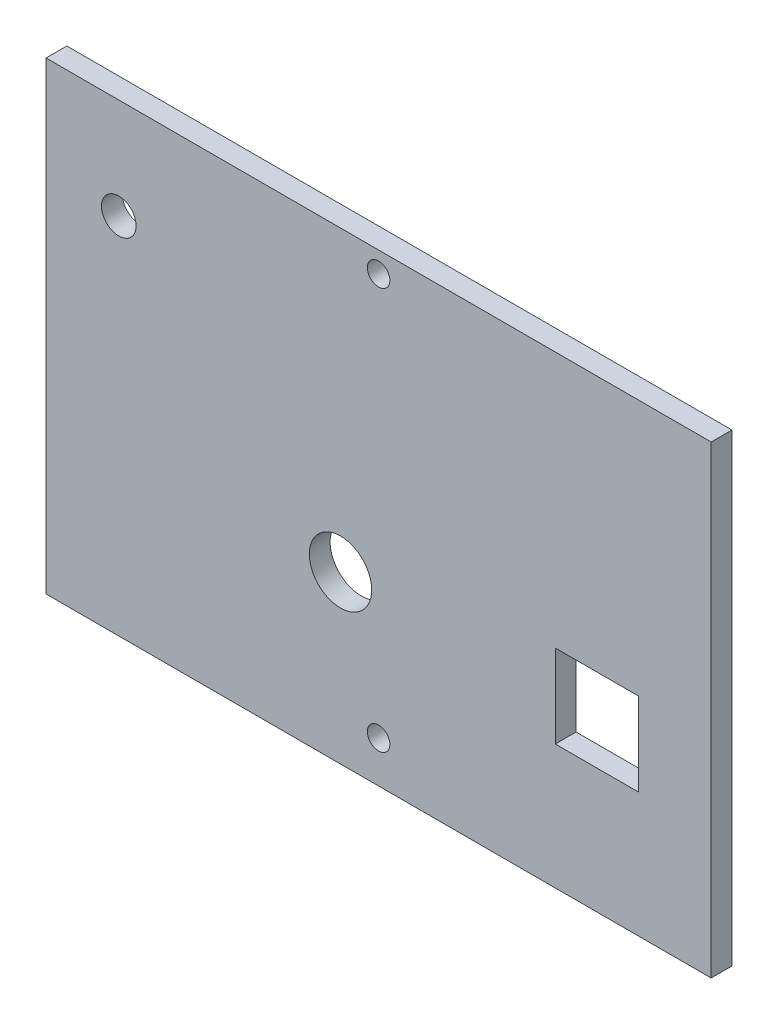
SolidWorks part; units mm, degrees
ref_plane "Alzado" through (0, 0, 0) normal (0, 0, 1) x (1, 0, 0)
ref_plane "Planta" through (0, 0, 0) normal (0, 1, 0) x (1, 0, 0)
ref_plane "Vista lateral" through (0, 0, 0) normal (1, 0, 0) x (0, 0, -1)
sketch "Croquis1" plane through (0, 0, 0) normal (0, 0, 1) x (1, 0, 0)
  line L1 (-48, -33.5) -> (48, -33.5)
  line L2 (-48, -33.5) -> (-48, 33.5)
  line L3 (-48, 33.5) -> (48, 33.5)
  line L4 (48, -33.5) -> (48, 33.5)
  line L5 (-48, -33.5) -> (48, 33.5) construction
  line L6 (-48, 33.5) -> (48, -33.5) construction
  point P0 (0, 0)
  dimension "D1" = 96
  dimension "D2" = 67
extrude "Saliente-Extruir1" add sketch "Croquis1" along normal blind 3
sketch "Croquis2" plane through (0, 0, 0) normal (0, 0, 1) x (1, 0, 0)
  line L0 (48, 33.5) -> (-48, 33.5) construction
  line L1 (-48, 33.5) -> (-48, -33.5) construction
  line L2 (-48, -33.5) -> (48, -33.5) construction
  line L3 (48, -33.5) -> (48, 33.5) construction
  line L4 (25.5, -3.5) -> (37.5, -3.5)
  line L5 (25.5, -3.5) -> (25.5, -15.5)
  line L6 (25.5, -15.5) -> (37.5, -15.5)
  line L7 (37.5, -3.5) -> (37.5, -15.5)
  line L8 (25.5, -3.5) -> (37.5, -15.5) construction
  line L9 (25.5, -15.5) -> (37.5, -3.5) construction
  circle A0 centre (-37.5, 19) radius 2.5
  circle A1 centre (-5.5, -9.5) radius 4.5
  circle A2 centre (0, 30.5) radius 1.625 construction
  circle A3 centre (0, -27.5) radius 1.625 construction
  circle A4 centre (0, 30.5) radius 1.625
  circle A5 centre (0, -27.5) radius 1.625
  point P10 (31.5, -9.5)
  dimension "D1" = 5
  dimension "D2" = 14.5
  dimension "D3" = 10.5
  dimension "D4" = 9
  dimension "D5" = 24
  dimension "D6" = 42.5
  dimension "D7" = 12
  dimension "D8" = 10.5
extrude "Cortar-Extruir1" cut sketch "Croquis2" along normal through all
sketch "Sketch3" plane through (0, 0, 3) normal (0, 0, 1) x (1, 0, 0)
  line L0 (-8.5534, 3.9138) -> (-10.3809, 5.4287)
  line L1 (-10.3809, 5.4287) -> (-11.4496, 5.4293)
  line L2 (-11.4594, 9.5301) -> (-10.3709, 9.5385)
  line L3 (-10.3709, 9.5385) -> (-8.4893, 11.097)
  line L4 (-13.2962, -3.2766) -> (-13.0236, -2.9318)
  line L5 (-13.0236, -2.9318) -> (-11.9522, -4.0032)
  line L6 (-11.9522, -4.0032) -> (-10.8808, -5.0746)
  line L7 (-10.8808, -5.0746) -> (-11.1578, -5.4598)
  line L8 (-12.4319, -8.8003) -> (-12.4544, -8.9466)
  line L9 (-12.4544, -8.9466) -> (-13.9772, -8.9466)
  line L10 (-13.9772, -8.9466) -> (-15.5, -8.9466)
  line L11 (-15.5, -8.9466) -> (-15.4742, -8.6833)
  line L12 (-11.1197, -3.158) -> (-12.1829, -2.0942)
  line L13 (-12.1829, -2.0942) -> (-12.034, -1.9601)
  line L14 (-6.3161, 0.4756) -> (-6.0918, 0.5)
  line L15 (-6.0918, 0.5) -> (-6.0918, -1.0438)
  line L16 (-6.0918, -1.0438) -> (-6.0918, -2.5876)
  line L17 (-6.0918, -2.5876) -> (-6.2186, -2.5876)
  line L18 (-13.2962, -3.2766) -> (-13.0236, -2.9318)
  line L19 (-13.0236, -2.9318) -> (-11.9522, -4.0032)
  line L20 (-11.9522, -4.0032) -> (-10.8808, -5.0746)
  line L21 (-10.8808, -5.0746) -> (-11.1578, -5.4598)
  line L22 (-12.4319, -8.8003) -> (-12.4544, -8.9466)
  line L23 (-12.4544, -8.9466) -> (-13.9772, -8.9466)
  line L24 (-13.9772, -8.9466) -> (-15.5, -8.9466)
  line L25 (-15.5, -8.9466) -> (-15.4742, -8.6833)
  line L26 (-11.1197, -3.158) -> (-12.1829, -2.0942)
  line L27 (-12.1829, -2.0942) -> (-12.034, -1.9601)
  line L28 (-6.3161, 0.4756) -> (-6.0918, 0.5)
  line L29 (-6.0918, 0.5) -> (-6.0918, -1.0438)
  line L30 (-6.0918, -1.0438) -> (-6.0918, -2.5876)
  line L31 (-6.0918, -2.5876) -> (-6.2186, -2.5876)
  line L32 (2.2962, -3.2797) -> (2.0236, -2.9349)
  line L33 (2.0236, -2.9349) -> (0.9522, -4.0063)
  line L34 (0.9522, -4.0063) -> (-0.1192, -5.0777)
  line L35 (-0.1192, -5.0777) -> (0.1578, -5.4629)
  line L36 (1.432, -8.8034) -> (1.4544, -8.9497)
  line L37 (1.4544, -8.9497) -> (2.9772, -8.9497)
  line L38 (2.9772, -8.9497) -> (4.5, -8.9497)
  line L39 (4.5, -8.9497) -> (4.4742, -8.6863)
  line L40 (0.1198, -3.161) -> (1.183, -2.0973)
  line L41 (1.183, -2.0973) -> (1.0341, -1.9632)
  line L42 (-4.6838, 0.4726) -> (-4.9082, 0.4969)
  line L43 (-4.9082, 0.4969) -> (-4.9082, -1.0469)
  line L44 (-4.9082, -1.0469) -> (-4.9082, -2.5907)
  line L45 (-4.9082, -2.5907) -> (-4.7814, -2.5907)
  spline S6 degree 3 poles (-0.8202, 1.6128) (-0.9788, 1.6868) (-1.1749, 1.8837) (-1.2459, 2.0401) knots 0 0 0 0 1 1 1 1
  spline S7 degree 3 poles (-1.2459, 2.0401) (-1.3134, 2.1887) (-1.3195, 2.4358) (-1.2593, 2.5799) knots 0 0 0 0 1 1 1 1
  spline S8 degree 3 poles (-1.2593, 2.5799) (-1.2353, 2.6374) (-1.1118, 2.8198) (-0.9849, 2.9853) knots 0 0 0 0 1 1 1 1
  spline S9 degree 3 poles (-0.9849, 2.9853) (-0.1909, 4.0204) (0.2972, 5.1684) (0.4875, 6.4482) knots 0 0 0 0 1 1 1 1
  spline S10 degree 3 poles (0.4875, 6.4482) (0.5521, 6.8829) (0.5739, 7.7404) (0.5311, 8.1623) knots 0 0 0 0 1 1 1 1
  spline S11 degree 3 poles (0.5311, 8.1623) (0.3809, 9.6412) (-0.1814, 11.0037) (-1.1081, 12.1347) knots 0 0 0 0 1 1 1 1
  spline S12 degree 3 poles (-1.1081, 12.1347) (-1.4073, 12.4997) (-1.4341, 12.5534) (-1.4339, 12.7873) knots 0 0 0 0 1 1 1 1
  spline S13 degree 3 poles (-1.4339, 12.7873) (-1.4338, 13.0274) (-1.3638, 13.1705) (-1.1544, 13.3588) knots 0 0 0 0 1 1 1 1
  spline S14 degree 3 poles (-1.1544, 13.3588) (-0.915, 13.574) (-0.6386, 13.6164) (-0.3646, 13.4798) knots 0 0 0 0 1 1 1 1
  spline S15 degree 3 poles (-0.3646, 13.4798) (-0.2018, 13.3988) (0.059, 13.1076) (0.4139, 12.6109) knots 0 0 0 0 1 1 1 1
  spline S16 degree 3 poles (0.4139, 12.6109) (2.55, 9.6214) (2.6127, 5.6441) (0.572, 2.5768) knots 0 0 0 0 1 1 1 1
  spline S17 degree 3 poles (0.572, 2.5768) (0.2805, 2.1386) (-0.02, 1.7704) (-0.1739, 1.6626) knots 0 0 0 0 1 1 1 1
  spline S18 degree 3 poles (-0.1739, 1.6626) (-0.3402, 1.5462) (-0.6298, 1.5239) (-0.8202, 1.6128) knots 0 0 0 0 1 1 1 1
  spline S19 degree 3 poles (-6.3936, 2.1887) (-6.5414, 2.2438) (-6.4712, 2.1877) (-8.5534, 3.9138) knots 0 0 0 0 1 1 1 1
  spline S20 degree 3 poles (-11.4496, 5.4293) (-12.4614, 5.4299) (-12.5254, 5.4332) (-12.6513, 5.4902) knots 0 0 0 0 1 1 1 1
  spline S21 degree 3 poles (-12.6513, 5.4902) (-12.8168, 5.5652) (-12.9049, 5.6462) (-12.9867, 5.798) knots 0 0 0 0 1 1 1 1
  spline S22 degree 3 poles (-12.9867, 5.798) (-13.0491, 5.914) (-13.0504, 5.9452) (-13.0587, 7.4165) knots 0 0 0 0 1 1 1 1
  spline S23 degree 3 poles (-13.0587, 7.4165) (-13.0641, 8.3817) (-13.0562, 8.9571) (-13.0366, 9.0299) knots 0 0 0 0 1 1 1 1
  spline S24 degree 3 poles (-13.0366, 9.0299) (-12.9899, 9.2034) (-12.8513, 9.3723) (-12.6909, 9.4513) knots 0 0 0 0 1 1 1 1
  spline S25 degree 3 poles (-12.6909, 9.4513) (-12.5492, 9.5211) (-12.5382, 9.5218) (-11.4594, 9.5301) knots 0 0 0 0 1 1 1 1
  spline S26 degree 3 poles (-8.4893, 11.097) (-7.4545, 11.9541) (-6.5691, 12.6801) (-6.5218, 12.7103) knots 0 0 0 0 1 1 1 1
  spline S27 degree 3 poles (-6.5218, 12.7103) (-6.4108, 12.7812) (-6.106, 12.8067) (-5.957, 12.7575) knots 0 0 0 0 1 1 1 1
  spline S28 degree 3 poles (-5.957, 12.7575) (-5.895, 12.737) (-5.7875, 12.6679) (-5.7179, 12.6037) knots 0 0 0 0 1 1 1 1
  spline S29 degree 3 poles (-5.7179, 12.6037) (-5.4811, 12.3855) (-5.4979, 12.7961) (-5.5066, 7.4221) knots 0 0 0 0 1 1 1 1
  spline S30 degree 3 poles (-5.5066, 7.4221) (-5.5138, 2.9591) (-5.5177, 2.6296) (-5.5652, 2.543) knots 0 0 0 0 1 1 1 1
  spline S31 degree 3 poles (-5.5652, 2.543) (-5.729, 2.2436) (-6.1068, 2.082) (-6.3936, 2.1887) knots 0 0 0 0 1 1 1 1
  spline S32 degree 3 poles (-3.1844, 3.9786) (-3.3419, 4.0501) (-3.5386, 4.2468) (-3.6101, 4.4043) knots 0 0 0 0 1 1 1 1
  spline S33 degree 3 poles (-3.6101, 4.4043) (-3.6448, 4.4807) (-3.6662, 4.5951) (-3.6666, 4.7063) knots 0 0 0 0 1 1 1 1
  spline S34 degree 3 poles (-3.6666, 4.7063) (-3.6672, 4.8614) (-3.6528, 4.909) (-3.5591, 5.061) knots 0 0 0 0 1 1 1 1
  spline S35 degree 3 poles (-3.5591, 5.061) (-3.2284, 5.5979) (-3.1539, 5.7359) (-3.0493, 6.0049) knots 0 0 0 0 1 1 1 1
  spline S36 degree 3 poles (-3.0493, 6.0049) (-2.5392, 7.3161) (-2.7224, 8.7295) (-3.5491, 9.8616) knots 0 0 0 0 1 1 1 1
  spline S37 degree 3 poles (-3.5491, 9.8616) (-3.805, 10.212) (-3.8478, 10.3544) (-3.7737, 10.6093) knots 0 0 0 0 1 1 1 1
  spline S38 degree 3 poles (-3.7737, 10.6093) (-3.7168, 10.8051) (-3.5172, 11.0405) (-3.3322, 11.13) knots 0 0 0 0 1 1 1 1
  spline S39 degree 3 poles (-3.3322, 11.13) (-3.1533, 11.2166) (-2.891, 11.2135) (-2.7188, 11.1228) knots 0 0 0 0 1 1 1 1
  spline S40 degree 3 poles (-2.7188, 11.1228) (-2.3902, 10.9497) (-1.7911, 9.978) (-1.5398, 9.2104) knots 0 0 0 0 1 1 1 1
  spline S41 degree 3 poles (-1.5398, 9.2104) (-1.333, 8.5788) (-1.2596, 8.0342) (-1.2822, 7.2982) knots 0 0 0 0 1 1 1 1
  spline S42 degree 3 poles (-1.2822, 7.2982) (-1.3009, 6.6874) (-1.3715, 6.2645) (-1.5408, 5.7489) knots 0 0 0 0 1 1 1 1
  spline S43 degree 3 poles (-1.5408, 5.7489) (-1.7247, 5.1889) (-2.2253, 4.2823) (-2.4595, 4.0853) knots 0 0 0 0 1 1 1 1
  spline S44 degree 3 poles (-2.4595, 4.0853) (-2.6611, 3.9156) (-2.9516, 3.8729) (-3.1844, 3.9786) knots 0 0 0 0 1 1 1 1
  spline S45 degree 3 poles (-12.3533, -16.8334) (-12.5644, -16.7047) (-13.2755, -15.8904) (-13.6875, -15.3056) knots 0 0 0 0 1 1 1 1
  spline S46 degree 3 poles (-13.6875, -15.3056) (-14.6338, -13.9625) (-15.2268, -12.412) (-15.4339, -10.7396) knots 0 0 0 0 1 1 1 1
  spline S47 degree 3 poles (-15.4339, -10.7396) (-15.4668, -10.4735) (-15.4938, -10.2246) (-15.4938, -10.1864) knots 0 0 0 0 1 1 1 1
  spline S48 degree 3 poles (-15.4938, -10.1864) (-15.4938, -10.121) (-15.4052, -10.117) (-13.9765, -10.117) knots 0 0 0 0 1 1 1 1
  spline S49 degree 3 poles (-13.9765, -10.117) (-12.3106, -10.117) (-12.4118, -10.1018) (-12.4118, -10.3522) knots 0 0 0 0 1 1 1 1
  spline S50 degree 3 poles (-12.4118, -10.3522) (-12.4118, -10.5585) (-12.2523, -11.2933) (-12.1167, -11.7117) knots 0 0 0 0 1 1 1 1
  spline S51 degree 3 poles (-12.1167, -11.7117) (-11.9396, -12.2584) (-11.5016, -13.1285) (-11.1734, -13.5856) knots 0 0 0 0 1 1 1 1
  spline S52 degree 3 poles (-11.1734, -13.5856) (-11.0285, -13.7876) (-10.7222, -14.15) (-10.493, -14.3911) knots 0 0 0 0 1 1 1 1
  spline S53 degree 3 poles (-10.493, -14.3911) (-9.8149, -15.1041) (-9.8174, -15.1137) (-10.932, -16.0891) knots 0 0 0 0 1 1 1 1
  spline S54 degree 3 poles (-10.932, -16.0891) (-11.3829, -16.4837) (-11.7906, -16.8281) (-11.838, -16.8545) knots 0 0 0 0 1 1 1 1
  spline S55 degree 3 poles (-11.838, -16.8545) (-11.9653, -16.9252) (-12.2198, -16.9148) (-12.3533, -16.8334) knots 0 0 0 0 1 1 1 1
  spline S56 degree 3 poles (-15.4742, -8.6833) (-15.2743, -6.6421) (-14.5652, -4.882) (-13.2962, -3.2766) knots 0 0 0 0 1 1 1 1
  spline S57 degree 3 poles (-11.1578, -5.4598) (-11.3102, -5.6717) (-11.5478, -6.0646) (-11.6857, -6.3328) knots 0 0 0 0 1 1 1 1
  spline S58 degree 3 poles (-11.6857, -6.3328) (-12.0744, -7.0882) (-12.2672, -7.7257) (-12.4319, -8.8003) knots 0 0 0 0 1 1 1 1
  spline S59 degree 3 poles (-12.034, -1.9601) (-11.5136, -1.4914) (-10.6988, -0.9406) (-9.997, -0.583) knots 0 0 0 0 1 1 1 1
  spline S60 degree 3 poles (-9.997, -0.583) (-8.8296, 0.0118) (-7.7635, 0.3184) (-6.3161, 0.4756) knots 0 0 0 0 1 1 1 1
  spline S61 degree 3 poles (-6.2186, -2.5876) (-6.3873, -2.5877) (-6.8943, -2.6785) (-7.2879, -2.7791) knots 0 0 0 0 1 1 1 1
  spline S62 degree 3 poles (-7.2879, -2.7791) (-8.1275, -2.9938) (-9.1702, -3.5132) (-9.798, -4.0295) knots 0 0 0 0 1 1 1 1
  spline S63 degree 3 poles (-9.798, -4.0295) (-9.8945, -4.1089) (-9.9922, -4.1846) (-10.015, -4.1978) knots 0 0 0 0 1 1 1 1
  spline S64 degree 3 poles (-10.015, -4.1978) (-10.0378, -4.211) (-10.5349, -3.743) (-11.1197, -3.1579) knots 0 0 0 0 1 1 1 1
  spline S65 degree 3 poles (-12.3533, -16.8334) (-12.5644, -16.7047) (-13.2755, -15.8904) (-13.6875, -15.3056) knots 0 0 0 0 1 1 1 1
  spline S66 degree 3 poles (-13.6875, -15.3056) (-14.6338, -13.9625) (-15.2268, -12.412) (-15.4339, -10.7396) knots 0 0 0 0 1 1 1 1
  spline S67 degree 3 poles (-15.4339, -10.7396) (-15.4668, -10.4735) (-15.4938, -10.2246) (-15.4938, -10.1864) knots 0 0 0 0 1 1 1 1
  spline S68 degree 3 poles (-15.4938, -10.1864) (-15.4938, -10.121) (-15.4052, -10.117) (-13.9765, -10.117) knots 0 0 0 0 1 1 1 1
  spline S69 degree 3 poles (-13.9765, -10.117) (-12.3106, -10.117) (-12.4118, -10.1018) (-12.4118, -10.3522) knots 0 0 0 0 1 1 1 1
  spline S70 degree 3 poles (-12.4118, -10.3522) (-12.4118, -10.5585) (-12.2523, -11.2933) (-12.1167, -11.7117) knots 0 0 0 0 1 1 1 1
  spline S71 degree 3 poles (-12.1167, -11.7117) (-11.9396, -12.2584) (-11.5016, -13.1285) (-11.1734, -13.5856) knots 0 0 0 0 1 1 1 1
  spline S72 degree 3 poles (-11.1734, -13.5856) (-11.0285, -13.7876) (-10.7222, -14.15) (-10.493, -14.3911) knots 0 0 0 0 1 1 1 1
  spline S73 degree 3 poles (-10.493, -14.3911) (-9.8149, -15.1041) (-9.8174, -15.1137) (-10.932, -16.0891) knots 0 0 0 0 1 1 1 1
  spline S74 degree 3 poles (-10.932, -16.0891) (-11.3829, -16.4837) (-11.7906, -16.8281) (-11.838, -16.8545) knots 0 0 0 0 1 1 1 1
  spline S75 degree 3 poles (-11.838, -16.8545) (-11.9653, -16.9252) (-12.2198, -16.9148) (-12.3533, -16.8334) knots 0 0 0 0 1 1 1 1
  spline S76 degree 3 poles (-15.4742, -8.6833) (-15.2743, -6.6421) (-14.5652, -4.882) (-13.2962, -3.2766) knots 0 0 0 0 1 1 1 1
  spline S77 degree 3 poles (-11.1578, -5.4598) (-11.3102, -5.6717) (-11.5478, -6.0646) (-11.6857, -6.3328) knots 0 0 0 0 1 1 1 1
  spline S78 degree 3 poles (-11.6857, -6.3328) (-12.0744, -7.0882) (-12.2672, -7.7257) (-12.4319, -8.8003) knots 0 0 0 0 1 1 1 1
  spline S79 degree 3 poles (-12.034, -1.9601) (-11.5136, -1.4914) (-10.6988, -0.9406) (-9.997, -0.583) knots 0 0 0 0 1 1 1 1
  spline S80 degree 3 poles (-9.997, -0.583) (-8.8296, 0.0118) (-7.7635, 0.3184) (-6.3161, 0.4756) knots 0 0 0 0 1 1 1 1
  spline S81 degree 3 poles (-6.2186, -2.5876) (-6.3873, -2.5877) (-6.8943, -2.6785) (-7.2879, -2.7791) knots 0 0 0 0 1 1 1 1
  spline S82 degree 3 poles (-7.2879, -2.7791) (-8.1275, -2.9938) (-9.1702, -3.5132) (-9.798, -4.0295) knots 0 0 0 0 1 1 1 1
  spline S83 degree 3 poles (-9.798, -4.0295) (-9.8945, -4.1089) (-9.9922, -4.1846) (-10.015, -4.1978) knots 0 0 0 0 1 1 1 1
  spline S84 degree 3 poles (-10.015, -4.1978) (-10.0378, -4.211) (-10.5349, -3.743) (-11.1197, -3.1579) knots 0 0 0 0 1 1 1 1
  spline S85 degree 3 poles (1.3533, -16.8365) (1.5644, -16.7078) (2.2755, -15.8935) (2.6875, -15.3087) knots 0 0 0 0 1 1 1 1
  spline S86 degree 3 poles (2.6875, -15.3087) (3.6339, -13.9655) (4.2269, -12.4151) (4.4339, -10.7427) knots 0 0 0 0 1 1 1 1
  spline S87 degree 3 poles (4.4339, -10.7427) (4.4668, -10.4766) (4.4938, -10.2277) (4.4938, -10.1895) knots 0 0 0 0 1 1 1 1
  spline S88 degree 3 poles (4.4938, -10.1895) (4.4938, -10.1241) (4.4052, -10.12) (2.9765, -10.12) knots 0 0 0 0 1 1 1 1
  spline S89 degree 3 poles (2.9765, -10.12) (1.3106, -10.12) (1.4118, -10.1048) (1.4118, -10.3553) knots 0 0 0 0 1 1 1 1
  spline S90 degree 3 poles (1.4118, -10.3553) (1.4118, -10.5616) (1.2523, -11.2964) (1.1168, -11.7148) knots 0 0 0 0 1 1 1 1
  spline S91 degree 3 poles (1.1168, -11.7148) (0.9396, -12.2615) (0.5017, -13.1316) (0.1735, -13.5887) knots 0 0 0 0 1 1 1 1
  spline S92 degree 3 poles (0.1735, -13.5887) (0.0285, -13.7906) (-0.2777, -14.1531) (-0.507, -14.3942) knots 0 0 0 0 1 1 1 1
  spline S93 degree 3 poles (-0.507, -14.3942) (-1.1851, -15.1072) (-1.1826, -15.1167) (-0.0679, -16.0922) knots 0 0 0 0 1 1 1 1
  spline S94 degree 3 poles (-0.0679, -16.0922) (0.383, -16.4868) (0.7907, -16.8312) (0.838, -16.8575) knots 0 0 0 0 1 1 1 1
  spline S95 degree 3 poles (0.838, -16.8575) (0.9653, -16.9283) (1.2199, -16.9179) (1.3533, -16.8365) knots 0 0 0 0 1 1 1 1
  spline S96 degree 3 poles (4.4742, -8.6863) (4.2743, -6.6452) (3.5653, -4.885) (2.2962, -3.2797) knots 0 0 0 0 1 1 1 1
  spline S97 degree 3 poles (0.1578, -5.4629) (0.3102, -5.6748) (0.5478, -6.0676) (0.6858, -6.3358) knots 0 0 0 0 1 1 1 1
  spline S98 degree 3 poles (0.6858, -6.3358) (1.0745, -7.0913) (1.2672, -7.7288) (1.432, -8.8034) knots 0 0 0 0 1 1 1 1
  spline S99 degree 3 poles (1.0341, -1.9632) (0.5136, -1.4945) (-0.3011, -0.9437) (-1.003, -0.5861) knots 0 0 0 0 1 1 1 1
  spline S100 degree 3 poles (-1.003, -0.5861) (-2.1704, 0.0088) (-3.2364, 0.3154) (-4.6838, 0.4726) knots 0 0 0 0 1 1 1 1
  spline S101 degree 3 poles (-4.7814, -2.5907) (-4.6127, -2.5908) (-4.1057, -2.6816) (-3.7121, -2.7822) knots 0 0 0 0 1 1 1 1
  spline S102 degree 3 poles (-3.7121, -2.7822) (-2.8725, -2.9969) (-1.8297, -3.5163) (-1.202, -4.0325) knots 0 0 0 0 1 1 1 1
  spline S103 degree 3 poles (-1.202, -4.0325) (-1.1054, -4.1119) (-1.0078, -4.1877) (-0.9849, -4.2008) knots 0 0 0 0 1 1 1 1
  spline S104 degree 3 poles (-0.9849, -4.2008) (-0.9621, -4.214) (-0.465, -3.7461) (0.1198, -3.161) knots 0 0 0 0 1 1 1 1
sketch "Sketch4" plane through (0, 0, 3) normal (0, 0, 1) x (1, 0, 0)
  circle A0 centre (-37.5, 19) radius 2.5 construction
  spline S8 degree 3 poles (-37.6749, 14.0491) (-37.7146, 14.0761) (-37.7676, 14.126) (-37.7928, 14.1599) knots 0 0 0 0 1 1 1 1
  spline S9 degree 3 poles (-37.7928, 14.1599) (-37.8364, 14.2188) (-37.8384, 14.2472) (-37.8384, 14.8079) knots 0 0 0 0 1 1 1 1
  spline S10 degree 3 poles (-37.8384, 14.8079) (-37.8384, 15.3686) (-37.8364, 15.3969) (-37.7928, 15.4558) knots 0 0 0 0 1 1 1 1
  spline S11 degree 3 poles (-37.7928, 15.4558) (-37.7676, 15.4897) (-37.7146, 15.5396) (-37.6749, 15.5666) knots 0 0 0 0 1 1 1 1
  spline S12 degree 3 poles (-37.6749, 15.5666) (-37.6253, 15.6003) (-37.5706, 15.6157) (-37.5, 15.6157) knots 0 0 0 0 1 1 1 1
  spline S13 degree 3 poles (-37.5, 15.6157) (-37.4294, 15.6157) (-37.3747, 15.6003) (-37.3251, 15.5666) knots 0 0 0 0 1 1 1 1
  spline S14 degree 3 poles (-37.3251, 15.5666) (-37.2854, 15.5396) (-37.2324, 15.4897) (-37.2072, 15.4558) knots 0 0 0 0 1 1 1 1
  spline S15 degree 3 poles (-37.2072, 15.4558) (-37.1636, 15.3969) (-37.1616, 15.3686) (-37.1616, 14.8079) knots 0 0 0 0 1 1 1 1
  spline S16 degree 3 poles (-37.1616, 14.8079) (-37.1616, 14.2471) (-37.1636, 14.2188) (-37.2072, 14.1599) knots 0 0 0 0 1 1 1 1
  spline S17 degree 3 poles (-37.2072, 14.1599) (-37.2324, 14.126) (-37.2854, 14.0761) (-37.3251, 14.0491) knots 0 0 0 0 1 1 1 1
  spline S18 degree 3 poles (-37.3251, 14.0491) (-37.3747, 14.0154) (-37.4294, 14) (-37.5, 14) knots 0 0 0 0 1 1 1 1
  spline S19 degree 3 poles (-37.5, 14) (-37.5706, 14) (-37.6253, 14.0154) (-37.6749, 14.0491) knots 0 0 0 0 1 1 1 1
  spline S20 degree 3 poles (-40.9439, 15.3966) (-40.9972, 15.4208) (-41.0548, 15.469) (-41.0803, 15.5107) knots 0 0 0 0 1 1 1 1
  spline S21 degree 3 poles (-41.0803, 15.5107) (-41.1045, 15.5505) (-41.1304, 15.6153) (-41.1379, 15.6549) knots 0 0 0 0 1 1 1 1
  spline S22 degree 3 poles (-41.1379, 15.6549) (-41.1463, 15.6995) (-41.1381, 15.762) (-41.1161, 15.8195) knots 0 0 0 0 1 1 1 1
  spline S23 degree 3 poles (-41.1161, 15.8195) (-41.0897, 15.8885) (-40.982, 16.0102) (-40.6932, 16.2971) knots 0 0 0 0 1 1 1 1
  spline S24 degree 3 poles (-40.6932, 16.2971) (-40.3677, 16.6204) (-40.2926, 16.6844) (-40.2238, 16.6971) knots 0 0 0 0 1 1 1 1
  spline S25 degree 3 poles (-40.2238, 16.6971) (-40.1788, 16.7054) (-40.1056, 16.7054) (-40.0611, 16.6971) knots 0 0 0 0 1 1 1 1
  spline S26 degree 3 poles (-40.0611, 16.6971) (-40.0104, 16.6876) (-39.9501, 16.6517) (-39.8992, 16.6008) knots 0 0 0 0 1 1 1 1
  spline S27 degree 3 poles (-39.8992, 16.6008) (-39.8482, 16.5499) (-39.8124, 16.4896) (-39.8029, 16.4389) knots 0 0 0 0 1 1 1 1
  spline S28 degree 3 poles (-39.8029, 16.4389) (-39.7946, 16.3944) (-39.7946, 16.3212) (-39.8029, 16.2762) knots 0 0 0 0 1 1 1 1
  spline S29 degree 3 poles (-39.8029, 16.2762) (-39.8155, 16.2077) (-39.8792, 16.1324) (-40.1929, 15.8152) knots 0 0 0 0 1 1 1 1
  spline S30 degree 3 poles (-40.1929, 15.8152) (-40.4232, 15.5821) (-40.6013, 15.4204) (-40.655, 15.3954) knots 0 0 0 0 1 1 1 1
  spline S31 degree 3 poles (-40.655, 15.3954) (-40.7031, 15.373) (-40.7669, 15.3547) (-40.7969, 15.3547) knots 0 0 0 0 1 1 1 1
  spline S32 degree 3 poles (-40.7969, 15.3547) (-40.827, 15.3547) (-40.8931, 15.3735) (-40.9439, 15.3966) knots 0 0 0 0 1 1 1 1
  spline S33 degree 3 poles (-34.345, 15.3954) (-34.3986, 15.4204) (-34.577, 15.5823) (-34.8073, 15.8152) knots 0 0 0 0 1 1 1 1
  spline S34 degree 3 poles (-34.8073, 15.8152) (-35.0439, 16.0544) (-35.1879, 16.217) (-35.1975, 16.2557) knots 0 0 0 0 1 1 1 1
  spline S35 degree 3 poles (-35.1975, 16.2557) (-35.2059, 16.2894) (-35.208, 16.3598) (-35.2021, 16.412) knots 0 0 0 0 1 1 1 1
  spline S36 degree 3 poles (-35.2021, 16.412) (-35.1962, 16.4642) (-35.1707, 16.5361) (-35.1453, 16.5718) knots 0 0 0 0 1 1 1 1
  spline S37 degree 3 poles (-35.1453, 16.5718) (-35.1199, 16.6074) (-35.0655, 16.6525) (-35.0245, 16.672) knots 0 0 0 0 1 1 1 1
  spline S38 degree 3 poles (-35.0245, 16.672) (-34.9834, 16.6915) (-34.909, 16.7075) (-34.8592, 16.7075) knots 0 0 0 0 1 1 1 1
  spline S39 degree 3 poles (-34.8592, 16.7075) (-34.8094, 16.7075) (-34.7421, 16.6935) (-34.7097, 16.6764) knots 0 0 0 0 1 1 1 1
  spline S40 degree 3 poles (-34.7097, 16.6764) (-34.6772, 16.6593) (-34.4824, 16.4751) (-34.2768, 16.267) knots 0 0 0 0 1 1 1 1
  spline S41 degree 3 poles (-34.2768, 16.267) (-34.0046, 15.9916) (-33.8958, 15.8664) (-33.8766, 15.8067) knots 0 0 0 0 1 1 1 1
  spline S42 degree 3 poles (-33.8766, 15.8067) (-33.8619, 15.7608) (-33.8569, 15.6936) (-33.8653, 15.6539) knots 0 0 0 0 1 1 1 1
  spline S43 degree 3 poles (-33.8653, 15.6539) (-33.8735, 15.6149) (-33.8993, 15.5518) (-33.9224, 15.5136) knots 0 0 0 0 1 1 1 1
  spline S44 degree 3 poles (-33.9224, 15.5136) (-33.9456, 15.4754) (-34.0066, 15.4238) (-34.058, 15.399) knots 0 0 0 0 1 1 1 1
  spline S45 degree 3 poles (-34.058, 15.399) (-34.1093, 15.3741) (-34.1753, 15.354) (-34.2045, 15.3542) knots 0 0 0 0 1 1 1 1
  spline S46 degree 3 poles (-34.2045, 15.3542) (-34.2338, 15.3545) (-34.297, 15.373) (-34.345, 15.3954) knots 0 0 0 0 1 1 1 1
  spline S47 degree 3 poles (-42.2816, 18.6747) (-42.3117, 18.6869) (-42.3593, 18.7185) (-42.3874, 18.7448) knots 0 0 0 0 1 1 1 1
  spline S48 degree 3 poles (-42.3874, 18.7448) (-42.4156, 18.7711) (-42.4525, 18.8191) (-42.4693, 18.8516) knots 0 0 0 0 1 1 1 1
  spline S49 degree 3 poles (-42.4693, 18.8516) (-42.4862, 18.884) (-42.5, 18.9538) (-42.5, 19.0066) knots 0 0 0 0 1 1 1 1
  spline S50 degree 3 poles (-42.5, 19.0066) (-42.5, 19.0704) (-42.4835, 19.1271) (-42.4509, 19.1749) knots 0 0 0 0 1 1 1 1
  spline S51 degree 3 poles (-42.4509, 19.1749) (-42.4239, 19.2146) (-42.374, 19.2677) (-42.3401, 19.2928) knots 0 0 0 0 1 1 1 1
  spline S52 degree 3 poles (-42.3401, 19.2928) (-42.2812, 19.3365) (-42.2529, 19.3385) (-41.6921, 19.3385) knots 0 0 0 0 1 1 1 1
  spline S53 degree 3 poles (-41.6921, 19.3385) (-41.1314, 19.3385) (-41.1031, 19.3365) (-41.0442, 19.2928) knots 0 0 0 0 1 1 1 1
  spline S54 degree 3 poles (-41.0442, 19.2928) (-41.0103, 19.2677) (-40.9604, 19.2146) (-40.9334, 19.1749) knots 0 0 0 0 1 1 1 1
  spline S55 degree 3 poles (-40.9334, 19.1749) (-40.8997, 19.1253) (-40.8843, 19.0706) (-40.8843, 19) knots 0 0 0 0 1 1 1 1
  spline S56 degree 3 poles (-40.8843, 19) (-40.8843, 18.9295) (-40.8996, 18.8747) (-40.9334, 18.8251) knots 0 0 0 0 1 1 1 1
  spline S57 degree 3 poles (-40.9334, 18.8251) (-40.9604, 18.7854) (-41.0102, 18.7324) (-41.0441, 18.7073) knots 0 0 0 0 1 1 1 1
  spline S58 degree 3 poles (-41.0441, 18.7073) (-41.1024, 18.664) (-41.1356, 18.6614) (-41.6664, 18.657) knots 0 0 0 0 1 1 1 1
  spline S59 degree 3 poles (-41.6664, 18.657) (-42.0089, 18.6542) (-42.2483, 18.6611) (-42.2816, 18.6747) knots 0 0 0 0 1 1 1 1
  spline S60 degree 3 poles (-33.8974, 18.6747) (-33.9274, 18.6869) (-33.975, 18.7185) (-34.0032, 18.7448) knots 0 0 0 0 1 1 1 1
  spline S61 degree 3 poles (-34.0032, 18.7448) (-34.0313, 18.7711) (-34.0682, 18.8191) (-34.085, 18.8516) knots 0 0 0 0 1 1 1 1
  spline S62 degree 3 poles (-34.085, 18.8516) (-34.1019, 18.884) (-34.1157, 18.9538) (-34.1157, 19.0066) knots 0 0 0 0 1 1 1 1
  spline S63 degree 3 poles (-34.1157, 19.0066) (-34.1157, 19.0704) (-34.0992, 19.1271) (-34.0666, 19.1749) knots 0 0 0 0 1 1 1 1
  spline S64 degree 3 poles (-34.0666, 19.1749) (-34.0396, 19.2146) (-33.9897, 19.2677) (-33.9558, 19.2928) knots 0 0 0 0 1 1 1 1
  spline S65 degree 3 poles (-33.9558, 19.2928) (-33.8969, 19.3365) (-33.8686, 19.3385) (-33.3079, 19.3385) knots 0 0 0 0 1 1 1 1
  spline S66 degree 3 poles (-33.3079, 19.3385) (-32.7472, 19.3385) (-32.7189, 19.3365) (-32.6599, 19.2928) knots 0 0 0 0 1 1 1 1
  spline S67 degree 3 poles (-32.6599, 19.2928) (-32.626, 19.2677) (-32.5761, 19.2146) (-32.5491, 19.1749) knots 0 0 0 0 1 1 1 1
  spline S68 degree 3 poles (-32.5491, 19.1749) (-32.5154, 19.1253) (-32.5, 19.0706) (-32.5, 19) knots 0 0 0 0 1 1 1 1
  spline S69 degree 3 poles (-32.5, 19) (-32.5, 18.9295) (-32.5154, 18.8747) (-32.5491, 18.8251) knots 0 0 0 0 1 1 1 1
  spline S70 degree 3 poles (-32.5491, 18.8251) (-32.5761, 18.7854) (-32.626, 18.7324) (-32.6598, 18.7073) knots 0 0 0 0 1 1 1 1
  spline S71 degree 3 poles (-32.6598, 18.7073) (-32.7182, 18.664) (-32.7513, 18.6614) (-33.2821, 18.657) knots 0 0 0 0 1 1 1 1
  spline S72 degree 3 poles (-33.2821, 18.657) (-33.6246, 18.6542) (-33.864, 18.6611) (-33.8974, 18.6747) knots 0 0 0 0 1 1 1 1
  spline S73 degree 3 poles (-40.3057, 21.3341) (-40.3417, 21.3568) (-40.5304, 21.5361) (-40.7249, 21.7325) knots 0 0 0 0 1 1 1 1
  spline S74 degree 3 poles (-40.7249, 21.7325) (-40.9195, 21.9289) (-41.089, 22.1172) (-41.1016, 22.151) knots 0 0 0 0 1 1 1 1
  spline S75 degree 3 poles (-41.1016, 22.151) (-41.1141, 22.1848) (-41.1245, 22.2497) (-41.1245, 22.2952) knots 0 0 0 0 1 1 1 1
  spline S76 degree 3 poles (-41.1245, 22.2952) (-41.1245, 22.345) (-41.1047, 22.4071) (-41.0748, 22.4515) knots 0 0 0 0 1 1 1 1
  spline S77 degree 3 poles (-41.0748, 22.4515) (-41.0475, 22.492) (-40.992, 22.5475) (-40.9515, 22.5748) knots 0 0 0 0 1 1 1 1
  spline S78 degree 3 poles (-40.9515, 22.5748) (-40.9063, 22.6053) (-40.8451, 22.6245) (-40.793, 22.6245) knots 0 0 0 0 1 1 1 1
  spline S79 degree 3 poles (-40.793, 22.6245) (-40.7464, 22.6245) (-40.6766, 22.6108) (-40.6379, 22.594) knots 0 0 0 0 1 1 1 1
  spline S80 degree 3 poles (-40.6379, 22.594) (-40.5993, 22.5772) (-40.4036, 22.3979) (-40.203, 22.1955) knots 0 0 0 0 1 1 1 1
  spline S81 degree 3 poles (-40.203, 22.1955) (-40.0025, 21.9931) (-39.8281, 21.7999) (-39.8155, 21.7661) knots 0 0 0 0 1 1 1 1
  spline S82 degree 3 poles (-39.8155, 21.7661) (-39.8029, 21.7323) (-39.7927, 21.6684) (-39.7929, 21.6242) knots 0 0 0 0 1 1 1 1
  spline S83 degree 3 poles (-39.7929, 21.6242) (-39.7931, 21.5799) (-39.8152, 21.5054) (-39.8421, 21.4586) knots 0 0 0 0 1 1 1 1
  spline S84 degree 3 poles (-39.8421, 21.4586) (-39.8689, 21.4119) (-39.9251, 21.3554) (-39.9669, 21.3331) knots 0 0 0 0 1 1 1 1
  spline S85 degree 3 poles (-39.9669, 21.3331) (-40.0088, 21.3108) (-40.0873, 21.2926) (-40.1416, 21.2927) knots 0 0 0 0 1 1 1 1
  spline S86 degree 3 poles (-40.1416, 21.2927) (-40.2006, 21.2927) (-40.2665, 21.3094) (-40.3057, 21.3341) knots 0 0 0 0 1 1 1 1
  spline S87 degree 3 poles (-35.028, 21.3289) (-35.0674, 21.3483) (-35.1196, 21.3922) (-35.144, 21.4264) knots 0 0 0 0 1 1 1 1
  spline S88 degree 3 poles (-35.144, 21.4264) (-35.1683, 21.4607) (-35.1938, 21.5226) (-35.2005, 21.5641) knots 0 0 0 0 1 1 1 1
  spline S89 degree 3 poles (-35.2005, 21.5641) (-35.2072, 21.6056) (-35.2058, 21.6769) (-35.1974, 21.7226) knots 0 0 0 0 1 1 1 1
  spline S90 degree 3 poles (-35.1974, 21.7226) (-35.1844, 21.7927) (-35.1233, 21.8651) (-34.8072, 22.1848) knots 0 0 0 0 1 1 1 1
  spline S91 degree 3 poles (-34.8072, 22.1848) (-34.601, 22.3933) (-34.4007, 22.5775) (-34.3621, 22.5942) knots 0 0 0 0 1 1 1 1
  spline S92 degree 3 poles (-34.3621, 22.5942) (-34.3235, 22.6108) (-34.2537, 22.6245) (-34.207, 22.6245) knots 0 0 0 0 1 1 1 1
  spline S93 degree 3 poles (-34.207, 22.6245) (-34.155, 22.6245) (-34.0938, 22.6053) (-34.0486, 22.5748) knots 0 0 0 0 1 1 1 1
  spline S94 degree 3 poles (-34.0486, 22.5748) (-34.008, 22.5475) (-33.9525, 22.492) (-33.9252, 22.4515) knots 0 0 0 0 1 1 1 1
  spline S95 degree 3 poles (-33.9252, 22.4515) (-33.8953, 22.4071) (-33.8756, 22.345) (-33.8756, 22.2951) knots 0 0 0 0 1 1 1 1
  spline S96 degree 3 poles (-33.8756, 22.2951) (-33.8756, 22.2497) (-33.8859, 22.1848) (-33.8985, 22.151) knots 0 0 0 0 1 1 1 1
  spline S97 degree 3 poles (-33.8985, 22.151) (-33.9111, 22.1172) (-34.0855, 21.9243) (-34.286, 21.7223) knots 0 0 0 0 1 1 1 1
  spline S98 degree 3 poles (-34.286, 21.7223) (-34.4866, 21.5204) (-34.6772, 21.3411) (-34.7097, 21.3239) knots 0 0 0 0 1 1 1 1
  spline S99 degree 3 poles (-34.7097, 21.3239) (-34.7421, 21.3067) (-34.8109, 21.2928) (-34.8625, 21.2931) knots 0 0 0 0 1 1 1 1
  spline S100 degree 3 poles (-34.8625, 21.2931) (-34.9141, 21.2933) (-34.9886, 21.3095) (-35.028, 21.3289) knots 0 0 0 0 1 1 1 1
  spline S101 degree 3 poles (-37.6749, 22.4334) (-37.7146, 22.4604) (-37.7676, 22.5103) (-37.7928, 22.5442) knots 0 0 0 0 1 1 1 1
  spline S102 degree 3 poles (-37.7928, 22.5442) (-37.8364, 22.6031) (-37.8384, 22.6314) (-37.8384, 23.1921) knots 0 0 0 0 1 1 1 1
  spline S103 degree 3 poles (-37.8384, 23.1921) (-37.8384, 23.7529) (-37.8364, 23.7812) (-37.7928, 23.8401) knots 0 0 0 0 1 1 1 1
  spline S104 degree 3 poles (-37.7928, 23.8401) (-37.7676, 23.874) (-37.7146, 23.9239) (-37.6749, 23.9509) knots 0 0 0 0 1 1 1 1
  spline S105 degree 3 poles (-37.6749, 23.9509) (-37.6253, 23.9846) (-37.5706, 24) (-37.5, 24) knots 0 0 0 0 1 1 1 1
  spline S106 degree 3 poles (-37.5, 24) (-37.4294, 24) (-37.3747, 23.9846) (-37.3251, 23.9509) knots 0 0 0 0 1 1 1 1
  spline S107 degree 3 poles (-37.3251, 23.9509) (-37.2854, 23.9239) (-37.2324, 23.874) (-37.2072, 23.8401) knots 0 0 0 0 1 1 1 1
  spline S108 degree 3 poles (-37.2072, 23.8401) (-37.1636, 23.7812) (-37.1616, 23.7528) (-37.1616, 23.1921) knots 0 0 0 0 1 1 1 1
  spline S109 degree 3 poles (-37.1616, 23.1921) (-37.1616, 22.6314) (-37.1636, 22.6031) (-37.2072, 22.5442) knots 0 0 0 0 1 1 1 1
  spline S110 degree 3 poles (-37.2072, 22.5442) (-37.2324, 22.5103) (-37.2854, 22.4604) (-37.3251, 22.4334) knots 0 0 0 0 1 1 1 1
  spline S111 degree 3 poles (-37.3251, 22.4334) (-37.3747, 22.3997) (-37.4294, 22.3843) (-37.5, 22.3843) knots 0 0 0 0 1 1 1 1
  spline S112 degree 3 poles (-37.5, 22.3843) (-37.5706, 22.3843) (-37.6253, 22.3997) (-37.6749, 22.4334) knots 0 0 0 0 1 1 1 1
  point P0 (-37.5, 21.5)
sketch "Sketch5" plane through (0, 0, 3) normal (0, 0, 1) x (1, 0, 0)
  line L0 (33.0588, -1.0832) -> (32.9906, -0.9736)
  line L1 (32.9906, -0.9736) -> (32.9824, 2.0181)
  line L2 (32.9824, 2.0181) -> (32.9742, 5.0098)
  line L3 (32.9742, 5.0098) -> (33.0523, 5.1695)
  line L4 (34.8115, 5.1733) -> (34.8898, 5.0161)
  line L5 (34.8898, 5.0161) -> (34.8898, 2.0536)
  line L6 (35.5645, 2.126) -> (35.5736, 5.0432)
  line L7 (35.5736, 5.0432) -> (35.6394, 5.1661)
  line L8 (37.4962, 1.987) -> (37.488, -0.9128)
  line L9 (37.488, -0.9128) -> (37.4055, -1.0693)
  spline S0 degree 3 poles (26.0182, -1.4529) (25.9405, -1.4255) (25.822, -1.3441) (25.7394, -1.2615) knots 0 0 0 0 1 1 1 1
  spline S1 degree 3 poles (25.7394, -1.2615) (25.4872, -1.0093) (25.5, -1.1862) (25.5, 2.05) knots 0 0 0 0 1 1 1 1
  spline S2 degree 3 poles (25.5, 2.05) (25.5, 5.2426) (25.4908, 5.1029) (25.7161, 5.3473) knots 0 0 0 0 1 1 1 1
  spline S3 degree 3 poles (25.7161, 5.3473) (25.8819, 5.5271) (26.0732, 5.6124) (26.3076, 5.6111) knots 0 0 0 0 1 1 1 1
  spline S4 degree 3 poles (26.3076, 5.6111) (26.41, 5.6105) (26.5408, 5.5903) (26.5984, 5.5663) knots 0 0 0 0 1 1 1 1
  spline S5 degree 3 poles (26.5984, 5.5663) (26.656, 5.5422) (27.8785, 4.8968) (29.3151, 4.1321) knots 0 0 0 0 1 1 1 1
  spline S6 degree 3 poles (29.3151, 4.1321) (31.0321, 3.2181) (31.9663, 2.7042) (32.0415, 2.6323) knots 0 0 0 0 1 1 1 1
  spline S7 degree 3 poles (32.0415, 2.6323) (32.3044, 2.381) (32.3649, 2.0208) (32.1986, 1.6977) knots 0 0 0 0 1 1 1 1
  spline S8 degree 3 poles (32.1986, 1.6977) (32.1495, 1.6022) (32.0615, 1.4861) (32.003, 1.4396) knots 0 0 0 0 1 1 1 1
  spline S9 degree 3 poles (32.003, 1.4396) (31.9046, 1.3614) (27.1767, -1.1737) (26.7012, -1.4032) knots 0 0 0 0 1 1 1 1
  spline S10 degree 3 poles (26.7012, -1.4032) (26.4596, -1.5197) (26.2506, -1.5349) (26.0182, -1.4529) knots 0 0 0 0 1 1 1 1
  spline S11 degree 3 poles (33.4464, -1.4335) (33.2787, -1.3548) (33.1622, -1.2495) (33.0588, -1.0832) knots 0 0 0 0 1 1 1 1
  spline S12 degree 3 poles (33.0523, 5.1695) (33.1408, 5.3504) (33.2627, 5.4653) (33.4616, 5.5554) knots 0 0 0 0 1 1 1 1
  spline S13 degree 3 poles (33.4616, 5.5554) (33.6591, 5.6449) (34.2062, 5.6449) (34.4036, 5.5554) knots 0 0 0 0 1 1 1 1
  spline S14 degree 3 poles (34.4036, 5.5554) (34.601, 5.466) (34.7223, 5.3523) (34.8115, 5.1733) knots 0 0 0 0 1 1 1 1
  spline S15 degree 3 poles (34.8898, 2.0536) (34.8898, -0.8441) (34.8885, -0.9116) (34.8292, -1.034) knots 0 0 0 0 1 1 1 1
  spline S16 degree 3 poles (34.8292, -1.034) (34.7457, -1.2066) (34.599, -1.3495) (34.4188, -1.4337) knots 0 0 0 0 1 1 1 1
  spline S17 degree 3 poles (34.4188, -1.4337) (34.2885, -1.4947) (34.2195, -1.5048) (33.9326, -1.5048) knots 0 0 0 0 1 1 1 1
  spline S18 degree 3 poles (33.9326, -1.5048) (33.6453, -1.5048) (33.577, -1.4948) (33.4464, -1.4335) knots 0 0 0 0 1 1 1 1
  spline S19 degree 3 poles (36.0977, -1.4621) (35.8579, -1.3765) (35.6603, -1.1628) (35.5897, -0.9128) knots 0 0 0 0 1 1 1 1
  spline S20 degree 3 poles (35.5897, -0.9128) (35.565, -0.8253) (35.5579, 0.0247) (35.5645, 2.126) knots 0 0 0 0 1 1 1 1
  spline S21 degree 3 poles (35.6394, 5.1661) (35.7263, 5.3284) (35.9444, 5.5264) (36.0927, 5.5777) knots 0 0 0 0 1 1 1 1
  spline S22 degree 3 poles (36.0927, 5.5777) (36.1659, 5.603) (36.3403, 5.6183) (36.546, 5.6175) knots 0 0 0 0 1 1 1 1
  spline S23 degree 3 poles (36.546, 5.6175) (36.9447, 5.6159) (37.098, 5.5586) (37.2917, 5.3385) knots 0 0 0 0 1 1 1 1
  spline S24 degree 3 poles (37.2917, 5.3385) (37.5145, 5.0855) (37.5054, 5.234) (37.4962, 1.987) knots 0 0 0 0 1 1 1 1
  spline S25 degree 3 poles (37.4055, -1.0693) (37.3075, -1.2552) (37.1475, -1.3951) (36.9601, -1.459) knots 0 0 0 0 1 1 1 1
  spline S26 degree 3 poles (36.9601, -1.459) (36.7884, -1.5175) (36.2583, -1.5194) (36.0977, -1.4621) knots 0 0 0 0 1 1 1 1
